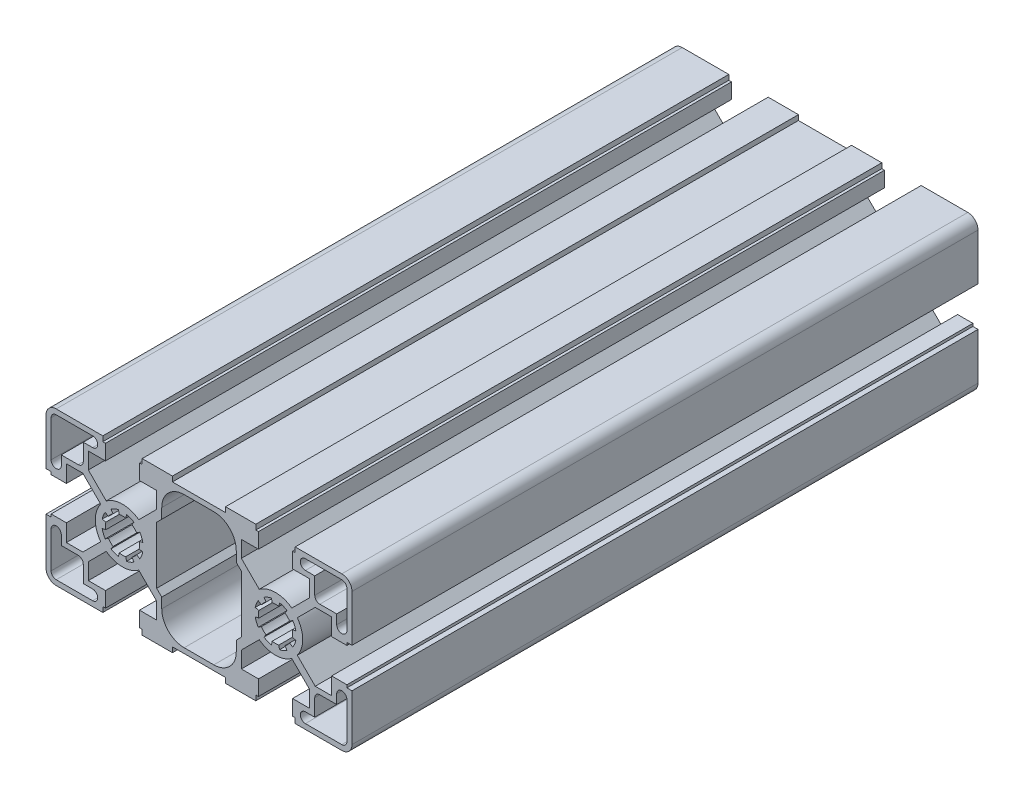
SolidWorks part; units mm, degrees
ref_plane "Front Plane" through (0, 0, 0) normal (0, 0, 1) x (1, 0, 0)
ref_plane "Top Plane" through (0, 0, 0) normal (0, 1, 0) x (1, 0, 0)
ref_plane "Right Plane" through (0, 0, 0) normal (1, 0, 0) x (0, 0, -1)
sketch "Sketch1" plane through (0, 0, 0) normal (0, 0, 1) x (1, 0, 0)
  line L0 (-27.5082, 0) -> (-17.5006, 0) construction
  line L1 (17.5006, 0) -> (27.5082, 0) construction
  line L2 (-42.0116, 22.5044) -> (-28.2956, 22.5044)
  line L3 (-28.2956, 22.5044) -> (-28.2956, 21.0058)
  line L4 (-28.2956, 21.0058) -> (-27.5082, 21.0058)
  line L5 (22.5044, -5.0038) -> (22.5044, 5.0038) construction
  line L6 (-27.5082, 21.0058) -> (-27.5082, 16.51)
  line L7 (-27.5082, 16.51) -> (-32.5501, 16.51)
  line L8 (-32.5501, 16.51) -> (-32.5501, 11.6801)
  line L9 (-32.5501, 11.6801) -> (-27.2854, 6.4154)
  line L11 (-34.1845, 10.0457) -> (-28.9198, 4.781)
  line L12 (-39.0144, 10.0457) -> (-34.1845, 10.0457)
  line L13 (-39.0144, 5.0038) -> (-39.0144, 10.0457)
  line L14 (-43.5102, 5.0038) -> (-39.0144, 5.0038)
  line L15 (-43.5102, 5.7912) -> (-43.5102, 5.0038)
  line L16 (-45.0088, 5.7912) -> (-43.5102, 5.7912)
  line L17 (-45.0088, 19.5072) -> (-45.0088, 5.7912)
  line L18 (-40.513, 11.5443) -> (-35.5473, 11.5443)
  line L19 (-40.513, 11.5443) -> (-40.513, 8.7884)
  line L20 (-34.0487, 18.0086) -> (-34.0487, 13.0429)
  line L21 (-43.5102, 19.5072) -> (-43.5102, 8.7884)
  line L23 (-34.0487, 18.0086) -> (-31.2928, 18.0086)
  line L24 (-42.0116, 21.0058) -> (-31.2928, 21.0058)
  line L25 (-21.3151, 5.9789) -> (-21.5282, 4.9077)
  line L26 (-23.6937, 5.9789) -> (-23.4806, 4.9077)
  line L27 (-17.4358, 3.3868) -> (-18.3439, 2.78)
  line L28 (-19.1176, 5.0686) -> (-19.7244, 4.1605)
  line L29 (-16.5255, -1.1893) -> (-17.5967, -0.9762)
  line L30 (-16.5255, 1.1893) -> (-17.5967, 0.9762)
  line L31 (-19.1176, -5.0686) -> (-19.7244, -4.1605)
  line L32 (-17.4358, -3.3868) -> (-18.3439, -2.78)
  line L33 (-23.6937, -5.9789) -> (-23.4806, -4.9077)
  line L34 (-21.3151, -5.9789) -> (-21.5282, -4.9077)
  line L35 (-27.573, -3.3868) -> (-26.6649, -2.78)
  line L36 (-25.8912, -5.0686) -> (-25.2844, -4.1605)
  line L37 (-28.4833, 1.1893) -> (-27.4121, 0.9762)
  line L38 (-28.4833, -1.1893) -> (-27.4121, -0.9762)
  line L39 (-25.8912, 5.0686) -> (-25.2844, 4.1605)
  line L40 (-27.573, 3.3868) -> (-26.6649, 2.78)
  line L41 (-7.8105, 22.5044) -> (-7.8105, 21.0058)
  line L42 (-7.8105, 21.0058) -> (7.8105, 21.0058)
  line L43 (-7.8105, 22.5044) -> (-16.7132, 22.5044)
  line L44 (-16.7132, 22.5044) -> (-16.7132, 21.0058)
  line L45 (-16.7132, 21.0058) -> (-17.5006, 21.0058)
  line L46 (-17.5006, 21.0058) -> (-17.5006, 16.51)
  line L47 (-17.5006, 16.51) -> (-12.4587, 16.51)
  line L48 (-12.4587, 16.51) -> (-12.4587, 11.6801)
  line L49 (-12.4587, 11.6801) -> (-17.7234, 6.4154)
  line L50 (-10.9601, 9.9099) -> (-12.4587, 8.4113)
  line L51 (7.8105, 21.0058) -> (7.8105, 22.5044)
  line L53 (-7.8105, -22.5044) -> (-16.7132, -22.5044)
  line L54 (7.8105, -22.5044) -> (16.7132, -22.5044)
  line L55 (7.8105, -21.0058) -> (7.8105, -22.5044)
  line L56 (-7.8105, -21.0058) -> (7.8105, -21.0058)
  line L57 (-7.8105, -22.5044) -> (-7.8105, -21.0058)
  line L58 (-40.513, -11.5443) -> (-35.5473, -11.5443)
  line L59 (4.3561, 19.5072) -> (-4.3561, 19.5072)
  line L60 (-10.9601, 12.9032) -> (-10.9601, 9.9099)
  line L61 (-12.4587, -8.4113) -> (-10.9601, -9.9099)
  line L62 (-12.4587, 8.4113) -> (-12.4587, -8.4113)
  line L63 (-10.9601, -12.9032) -> (-10.9601, -9.9099)
  line L64 (4.3561, -19.5072) -> (-4.3561, -19.5072)
  line L65 (10.9601, 12.9032) -> (10.9601, 9.9099)
  line L66 (10.9601, -12.9032) -> (10.9601, -9.9099)
  line L67 (12.4587, 8.4113) -> (12.4587, -8.4113)
  line L68 (10.9601, -9.9099) -> (12.4587, -8.4113)
  line L69 (10.9601, 9.9099) -> (12.4587, 8.4113)
  line L70 (-12.4587, -11.6801) -> (-17.7234, -6.4154)
  line L71 (-12.4587, -16.51) -> (-12.4587, -11.6801)
  line L72 (-17.5006, -16.51) -> (-12.4587, -16.51)
  line L73 (-17.5006, -21.0058) -> (-17.5006, -16.51)
  line L74 (-16.7132, -21.0058) -> (-17.5006, -21.0058)
  line L75 (-16.7132, -22.5044) -> (-16.7132, -21.0058)
  line L76 (-34.0487, -18.0086) -> (-31.2928, -18.0086)
  line L77 (-42.0116, -21.0058) -> (-31.2928, -21.0058)
  line L78 (-42.0116, -22.5044) -> (-28.2956, -22.5044)
  line L79 (-28.2956, -22.5044) -> (-28.2956, -21.0058)
  line L80 (-28.2956, -21.0058) -> (-27.5082, -21.0058)
  line L81 (-27.5082, -21.0058) -> (-27.5082, -16.51)
  line L82 (-27.5082, -16.51) -> (-32.5501, -16.51)
  line L83 (-32.5501, -16.51) -> (-32.5501, -11.6801)
  line L84 (-32.5501, -11.6801) -> (-27.2854, -6.4154)
  line L85 (-34.1845, -10.0457) -> (-28.9198, -4.781)
  line L86 (-43.5102, -19.5072) -> (-43.5102, -8.7884)
  line L87 (-34.0487, -18.0086) -> (-34.0487, -13.0429)
  line L88 (-40.513, -11.5443) -> (-40.513, -8.7884)
  line L89 (-45.0088, -19.5072) -> (-45.0088, -5.7912)
  line L90 (-45.0088, -5.7912) -> (-43.5102, -5.7912)
  line L91 (-43.5102, -5.7912) -> (-43.5102, -5.0038)
  line L92 (-43.5102, -5.0038) -> (-39.0144, -5.0038)
  line L93 (-39.0144, -5.0038) -> (-39.0144, -10.0457)
  line L94 (-39.0144, -10.0457) -> (-34.1845, -10.0457)
  line L96 (42.0116, 21.0058) -> (31.2928, 21.0058)
  line L97 (42.0116, 22.5044) -> (28.2956, 22.5044)
  line L98 (34.0487, 18.0086) -> (31.2928, 18.0086)
  line L99 (27.5082, 21.0058) -> (27.5082, 16.51)
  line L100 (28.2956, 21.0058) -> (27.5082, 21.0058)
  line L101 (28.2956, 22.5044) -> (28.2956, 21.0058)
  line L102 (17.5006, 21.0058) -> (17.5006, 16.51)
  line L103 (16.7132, 21.0058) -> (17.5006, 21.0058)
  line L104 (16.7132, 22.5044) -> (16.7132, 21.0058)
  line L105 (7.8105, 22.5044) -> (16.7132, 22.5044)
  line L106 (39.0144, -10.0457) -> (34.1845, -10.0457)
  line L107 (39.0144, -5.0038) -> (39.0144, -10.0457)
  line L108 (43.5102, -5.0038) -> (39.0144, -5.0038)
  line L109 (43.5102, -5.7912) -> (43.5102, -5.0038)
  line L110 (45.0088, -5.7912) -> (43.5102, -5.7912)
  line L111 (45.0088, -19.5072) -> (45.0088, -5.7912)
  line L112 (40.513, -11.5443) -> (35.5473, -11.5443)
  line L113 (40.513, -11.5443) -> (40.513, -8.7884)
  line L114 (34.0487, -18.0086) -> (34.0487, -13.0429)
  line L115 (43.5102, -19.5072) -> (43.5102, -8.7884)
  line L116 (34.1845, -10.0457) -> (28.9198, -4.781)
  line L117 (32.5501, -11.6801) -> (27.2854, -6.4154)
  line L118 (32.5501, -16.51) -> (32.5501, -11.6801)
  line L119 (27.5082, -16.51) -> (32.5501, -16.51)
  line L120 (27.5082, -21.0058) -> (27.5082, -16.51)
  line L121 (28.2956, -21.0058) -> (27.5082, -21.0058)
  line L122 (28.2956, -22.5044) -> (28.2956, -21.0058)
  line L123 (42.0116, -22.5044) -> (28.2956, -22.5044)
  line L124 (42.0116, -21.0058) -> (31.2928, -21.0058)
  line L125 (34.0487, -18.0086) -> (31.2928, -18.0086)
  line L126 (16.7132, -22.5044) -> (16.7132, -21.0058)
  line L127 (16.7132, -21.0058) -> (17.5006, -21.0058)
  line L128 (17.5006, -21.0058) -> (17.5006, -16.51)
  line L129 (17.5006, -16.51) -> (12.4587, -16.51)
  line L130 (12.4587, -16.51) -> (12.4587, -11.6801)
  line L131 (12.4587, -11.6801) -> (17.7234, -6.4154)
  line L132 (12.4587, 11.6801) -> (17.7234, 6.4154)
  line L133 (12.4587, 16.51) -> (12.4587, 11.6801)
  line L134 (27.573, 3.3868) -> (26.6649, 2.78)
  line L135 (25.8912, 5.0686) -> (25.2844, 4.1605)
  line L136 (28.4833, -1.1893) -> (27.4121, -0.9762)
  line L137 (28.4833, 1.1893) -> (27.4121, 0.9762)
  line L138 (25.8912, -5.0686) -> (25.2844, -4.1605)
  line L139 (27.573, -3.3868) -> (26.6649, -2.78)
  line L140 (21.3151, -5.9789) -> (21.5282, -4.9077)
  line L141 (23.6937, -5.9789) -> (23.4806, -4.9077)
  line L142 (17.4358, -3.3868) -> (18.3439, -2.78)
  line L143 (19.1176, -5.0686) -> (19.7244, -4.1605)
  line L144 (16.5255, 1.1893) -> (17.5967, 0.9762)
  line L145 (16.5255, -1.1893) -> (17.5967, -0.9762)
  line L146 (19.1176, 5.0686) -> (19.7244, 4.1605)
  line L147 (17.4358, 3.3868) -> (18.3439, 2.78)
  line L148 (23.6937, 5.9789) -> (23.4806, 4.9077)
  line L149 (21.3151, 5.9789) -> (21.5282, 4.9077)
  line L150 (43.5102, 19.5072) -> (43.5102, 8.7884)
  line L151 (34.0487, 18.0086) -> (34.0487, 13.0429)
  line L152 (40.513, 11.5443) -> (40.513, 8.7884)
  line L153 (40.513, 11.5443) -> (35.5473, 11.5443)
  line L154 (45.0088, 19.5072) -> (45.0088, 5.7912)
  line L155 (45.0088, 5.7912) -> (43.5102, 5.7912)
  line L156 (43.5102, 5.7912) -> (43.5102, 5.0038)
  line L157 (43.5102, 5.0038) -> (39.0144, 5.0038)
  line L158 (39.0144, 5.0038) -> (39.0144, 10.0457)
  line L159 (39.0144, 10.0457) -> (34.1845, 10.0457)
  line L160 (34.1845, 10.0457) -> (28.9198, 4.781)
  line L161 (32.5501, 11.6801) -> (27.2854, 6.4154)
  line L162 (32.5501, 16.51) -> (32.5501, 11.6801)
  line L163 (12.4587, 16.51) -> (17.5006, 16.51)
  line L164 (27.5082, 16.51) -> (32.5501, 16.51)
  arc A0 (-45.0088, 19.5072) -> (-42.0116, 22.5044) centre (-42.0116, 19.5072) cw
  arc A1 (-43.5102, 8.7884) -> (-40.513, 8.7884) centre (-42.0116, 8.7884) ccw
  arc A2 (-43.5102, 19.5072) -> (-42.0116, 21.0058) centre (-42.0116, 19.5072) cw
  arc A3 (-31.2928, 21.0058) -> (-31.2928, 18.0086) centre (-31.2928, 19.5072) cw
  arc A4 (-34.0487, 13.0429) -> (-35.5473, 11.5443) centre (-35.5473, 13.0429) cw
  arc A6 (-21.5282, 4.9077) -> (-23.4806, 4.9077) centre (-22.5044, 0) ccw
  arc A7 (-27.573, 3.3868) -> (-28.4833, 1.1893) centre (-22.5044, 0) ccw
  arc A8 (-18.3439, 2.78) -> (-19.7244, 4.1605) centre (-22.5044, 0) ccw
  arc A9 (-17.5967, -0.9762) -> (-17.5967, 0.9762) centre (-22.5044, 0) ccw
  arc A10 (-19.7244, -4.1605) -> (-18.3439, -2.78) centre (-22.5044, 0) ccw
  arc A11 (-23.4806, -4.9077) -> (-21.5282, -4.9077) centre (-22.5044, 0) ccw
  arc A12 (-26.6649, -2.78) -> (-25.2844, -4.1605) centre (-22.5044, 0) ccw
  arc A13 (-27.4121, 0.9762) -> (-27.4121, -0.9762) centre (-22.5044, 0) ccw
  arc A14 (-25.2844, 4.1605) -> (-26.6649, 2.78) centre (-22.5044, 0) ccw
  arc A15 (-28.4833, -1.1893) -> (-27.573, -3.3868) centre (-22.5044, 0) ccw
  arc A16 (-25.8912, -5.0686) -> (-23.6937, -5.9789) centre (-22.5044, 0) ccw
  arc A17 (-21.3151, -5.9789) -> (-19.1176, -5.0686) centre (-22.5044, 0) ccw
  arc A18 (-17.4358, -3.3868) -> (-16.5255, -1.1893) centre (-22.5044, 0) ccw
  arc A19 (-16.5255, 1.1893) -> (-17.4358, 3.3868) centre (-22.5044, 0) ccw
  arc A20 (-19.1176, 5.0686) -> (-21.3151, 5.9789) centre (-22.5044, 0) ccw
  arc A21 (-23.6937, 5.9789) -> (-25.8912, 5.0686) centre (-22.5044, 0) ccw
  arc A22 (-34.0487, -13.0429) -> (-35.5473, -11.5443) centre (-35.5473, -13.0429) ccw
  arc A23 (-4.3561, 19.5072) -> (-10.9601, 12.9032) centre (-4.3561, 12.9032) ccw
  arc A24 (-4.3561, -19.5072) -> (-10.9601, -12.9032) centre (-4.3561, -12.9032) cw
  arc A25 (4.3561, 19.5072) -> (10.9601, 12.9032) centre (4.3561, 12.9032) cw
  arc A26 (4.3561, -19.5072) -> (10.9601, -12.9032) centre (4.3561, -12.9032) ccw
  arc A27 (-31.2928, -21.0058) -> (-31.2928, -18.0086) centre (-31.2928, -19.5072) ccw
  arc A28 (-43.5102, -19.5072) -> (-42.0116, -21.0058) centre (-42.0116, -19.5072) ccw
  arc A29 (-45.0088, -19.5072) -> (-42.0116, -22.5044) centre (-42.0116, -19.5072) ccw
  arc A30 (-43.5102, -8.7884) -> (-40.513, -8.7884) centre (-42.0116, -8.7884) cw
  arc A31 (-17.7234, 6.4154) -> (-27.2854, 6.4154) centre (-22.5044, 0) ccw
  arc A32 (-27.2854, -6.4154) -> (-17.7234, -6.4154) centre (-22.5044, 0) ccw
  arc A33 (-28.9198, 4.781) -> (-28.9198, -4.781) centre (-22.5044, 0) ccw
  arc A34 (45.0088, 19.5072) -> (42.0116, 22.5044) centre (42.0116, 19.5072) ccw
  arc A35 (43.5102, 19.5072) -> (42.0116, 21.0058) centre (42.0116, 19.5072) ccw
  arc A36 (31.2928, 21.0058) -> (31.2928, 18.0086) centre (31.2928, 19.5072) ccw
  arc A37 (28.9198, 4.781) -> (28.9198, -4.781) centre (22.5044, 0) cw
  arc A38 (27.2854, -6.4154) -> (17.7234, -6.4154) centre (22.5044, 0) cw
  arc A39 (17.7234, 6.4154) -> (27.2854, 6.4154) centre (22.5044, 0) cw
  arc A40 (43.5102, -8.7884) -> (40.513, -8.7884) centre (42.0116, -8.7884) ccw
  arc A41 (34.0487, -13.0429) -> (35.5473, -11.5443) centre (35.5473, -13.0429) cw
  arc A42 (45.0088, -19.5072) -> (42.0116, -22.5044) centre (42.0116, -19.5072) cw
  arc A43 (43.5102, -19.5072) -> (42.0116, -21.0058) centre (42.0116, -19.5072) cw
  arc A44 (31.2928, -21.0058) -> (31.2928, -18.0086) centre (31.2928, -19.5072) cw
  arc A45 (23.6937, 5.9789) -> (25.8912, 5.0686) centre (22.5044, 0) cw
  arc A46 (19.1176, 5.0686) -> (21.3151, 5.9789) centre (22.5044, 0) cw
  arc A47 (16.5255, 1.1893) -> (17.4358, 3.3868) centre (22.5044, 0) cw
  arc A48 (17.4358, -3.3868) -> (16.5255, -1.1893) centre (22.5044, 0) cw
  arc A49 (21.3151, -5.9789) -> (19.1176, -5.0686) centre (22.5044, 0) cw
  arc A50 (25.8912, -5.0686) -> (23.6937, -5.9789) centre (22.5044, 0) cw
  arc A51 (28.4833, -1.1893) -> (27.573, -3.3868) centre (22.5044, 0) cw
  arc A52 (25.2844, 4.1605) -> (26.6649, 2.78) centre (22.5044, 0) cw
  arc A53 (27.4121, 0.9762) -> (27.4121, -0.9762) centre (22.5044, 0) cw
  arc A54 (26.6649, -2.78) -> (25.2844, -4.1605) centre (22.5044, 0) cw
  arc A55 (23.4806, -4.9077) -> (21.5282, -4.9077) centre (22.5044, 0) cw
  arc A56 (19.7244, -4.1605) -> (18.3439, -2.78) centre (22.5044, 0) cw
  arc A57 (17.5967, -0.9762) -> (17.5967, 0.9762) centre (22.5044, 0) cw
  arc A58 (18.3439, 2.78) -> (19.7244, 4.1605) centre (22.5044, 0) cw
  arc A59 (27.573, 3.3868) -> (28.4833, 1.1893) centre (22.5044, 0) cw
  arc A60 (21.5282, 4.9077) -> (23.4806, 4.9077) centre (22.5044, 0) cw
  arc A62 (34.0487, 13.0429) -> (35.5473, 11.5443) centre (35.5473, 13.0429) ccw
  arc A63 (43.5102, 8.7884) -> (40.513, 8.7884) centre (42.0116, 8.7884) cw
extrude "Boss-Extrude1" add sketch "Sketch1" along normal mid plane 184.15
hole_wizard "CBORE for 3/8 Socket Head Cap Screw1" positions "Sketch2" profile "Sketch3" counterbore size "3/8" standard "ANSI Inch"
sketch "Sketch2" plane through (0, 22.5044, 0) normal (0, 1, 0) x (1, 0, 0)
  point P0 (22.5044, 197.993)
  point P3 (22.5044, 22.352)
sketch "Sketch3" plane through (22.5044, 22.5044, -197.993) normal (1, 0, 0) x (0, 0, 1)
  line L0 (0, 0) -> (0, 45.0088)
  line L1 (0, 45.0088) -> (5.0419, 45.0088)
  line L3 (5.0419, 45.0088) -> (5.0419, 9.525)
  line L4 (5.0419, 9.525) -> (7.9375, 9.525)
  line L5 (7.9375, 9.525) -> (7.9375, 0)
  line L7 (7.9375, 0) -> (0, 0)
  line L11 (0, -6.35) -> (0, 107.95) construction
  dimension "Thru Hole Dia." = 10.0838
  dimension "Thru Hole Depth" = 45.0088
  dimension "C'Bore Dia." = 15.875
  dimension "C'Bore Depth" = 9.525
